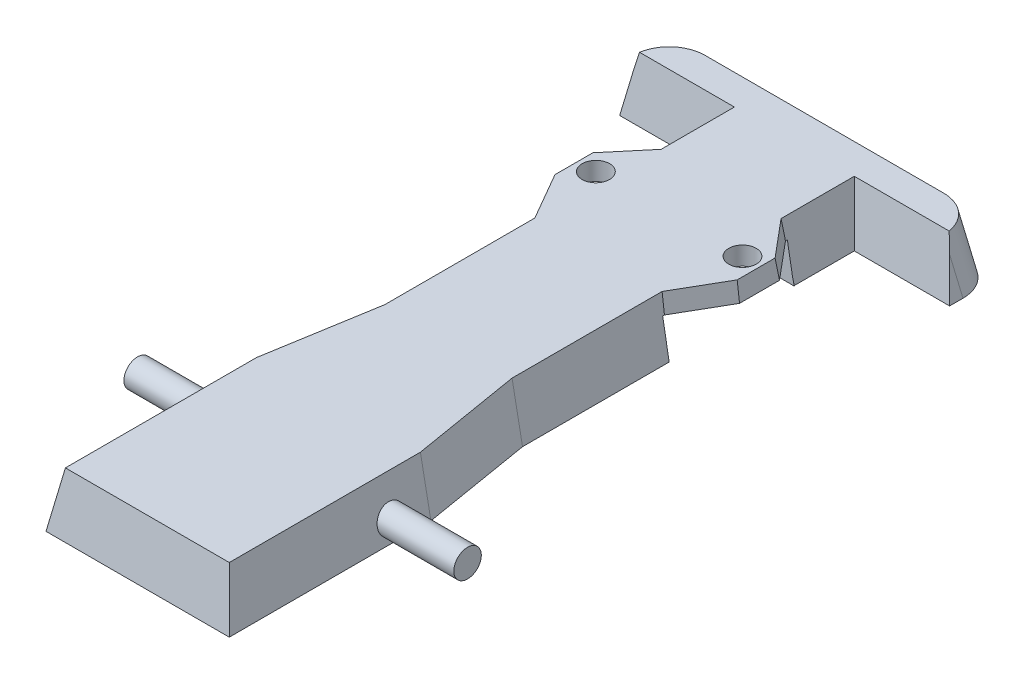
SolidWorks part; units mm, degrees
ref_plane "Front Plane" through (0, 0, 0) normal (0, 0, 1) x (1, 0, 0)
ref_plane "Top Plane" through (0, 0, 0) normal (0, 1, 0) x (1, 0, 0)
ref_plane "Right Plane" through (0, 0, 0) normal (1, 0, 0) x (0, 0, -1)
sketch "Sketch1" plane through (0, 0, 0) normal (0, 1, 0) x (1, 0, 0)
  line L0 (-254, 76.2) -> (254, 76.2) construction
  line L1 (-127, -355.6) -> (127, -355.6)
  line L5 (-139.7, 406.4) -> (-96.52, 457.8599)
  line L6 (-139.7, 345.3911) -> (-101.6, 279.4)
  line L10 (0, 609.6) -> (0, -355.6) construction
  line L12 (-139.7, 406.4) -> (-139.7, 345.3911)
  line L13 (254, 0) -> (-254, 0) construction
  line L15 (-127, -355.6) -> (-127, -76.2)
  line L16 (127, -355.6) -> (127, -76.2)
  line L18 (-254, -76.2) -> (254, 76.2) construction
  line L19 (254, -76.2) -> (-254, 76.2) construction
  line L22 (-101.6, 279.4) -> (-101.6, 76.2)
  line L23 (101.6, 279.4) -> (101.6, 76.2)
  line L24 (139.7, 345.3911) -> (101.6, 279.4)
  line L25 (139.7, 406.4) -> (96.52, 457.8599)
  line L26 (139.7, 406.4) -> (139.7, 345.3911)
  line L27 (-228.6, 609.6) -> (228.6, 609.6)
  line L29 (-228.6, 541.02) -> (-228.6, 609.6)
  line L31 (228.6, 541.02) -> (228.6, 609.6)
  line L32 (-228.6, 541.02) -> (-96.52, 541.02)
  line L33 (-96.52, 541.02) -> (-96.52, 457.8599)
  line L34 (96.52, 541.02) -> (228.6, 541.02)
  line L35 (96.52, 457.8599) -> (96.52, 541.02)
  line L36 (101.6, 76.2) -> (127, -76.2)
  line L37 (-101.6, 76.2) -> (-127, -76.2)
  circle A0 centre (-101.6, 381) radius 19.05
  circle A1 centre (101.6, 381) radius 19.05
  point P0 (0, 0)
extrude "Boss-Extrude1" add sketch "Sketch1" along normal blind 76.2
sketch "Sketch2" plane through (0, 0, 0) normal (0, -1, 0) x (1, 0, 0)
  line L1 (-139.7, -279.4) -> (139.7, -279.4)
  line L2 (-139.7, -279.4) -> (-139.7, -457.2)
  line L3 (-139.7, -457.2) -> (139.7, -457.2)
  line L4 (139.7, -279.4) -> (139.7, -457.2)
  dimension "D1" = 177.8
  dimension "D2" = 279.4
  dimension "D3" = 139.7
extrude "Cut-Extrude1" cut sketch "Sketch2" against normal blind 50.8
sketch "Sketch3" plane through (0, 76.2, 0) normal (0, 1, 0) x (1, 0, 0)
  line L0 (127, -355.6) -> (127, -76.2) construction
  line L1 (69.85, -146.05) -> (107.95, -146.05)
  line L2 (69.85, -146.05) -> (69.85, -107.95)
  line L3 (69.85, -107.95) -> (107.95, -107.95)
  line L4 (107.95, -146.05) -> (107.95, -107.95)
  line L5 (69.85, -146.05) -> (107.95, -107.95) construction
  line L6 (69.85, -107.95) -> (107.95, -146.05) construction
  line L7 (0, 0) -> (0, -355.6) construction
  line L8 (-127, -355.6) -> (127, -355.6) construction
  line L9 (-69.85, -107.95) -> (-107.95, -107.95)
  line L10 (-107.95, -146.05) -> (-107.95, -107.95)
  line L11 (-69.85, -146.05) -> (-107.95, -146.05)
  line L12 (-69.85, -146.05) -> (-69.85, -107.95)
  point P0 (88.9, -127)
extrude "Cut-Extrude2" [suppressed] cut sketch "Sketch3" against normal through all both and the other way through all
sketch "Sketch5" plane through (0, 76.2, 0) normal (0, 1, 0) x (1, 0, 0)
  line L0 (101.6, 381) -> (139.7, 381) construction
  line L1 (139.7, 345.3911) -> (139.7, 406.4) construction
  line L2 (0, -127) -> (101.6, -127) construction
  point P7 (0, -127)
  point P8 (101.6, -127)
  point P9 (0, 0)
  dimension "D1" = 508
sketch "Sketch6" plane through (139.7, 0, 0) normal (1, 0, 0) x (0, 0, -1)
  line L0 (381, 76.2) -> (381, 50.8) construction
  line L1 (345.3911, 76.2) -> (406.4, 76.2) construction
  line L2 (406.4, 50.8) -> (345.3911, 50.8) construction
sketch "Sketch4" plane through (-127, 0, 0) normal (-1, 0, 0) x (0, 0, 1)
  line L0 (76.2, 25.4) -> (355.6, 25.4) construction
  line L5 (-381, 76.2) -> (-381, 50.8) construction
  line L6 (76.2, 76.2) -> (76.2, 0) construction
  line L7 (355.6, 76.2) -> (355.6, 0) construction
  line L8 (76.2, 76.2) -> (355.6, 76.2) construction
  circle A0 centre (127, 25.4) radius 19.05
  point P12 (127, 25.4)
  dimension "D1" = 38.1
  dimension "D2" = 508
  dimension "D3" = 50.8
extrude "Boss-Extrude2" add sketch "Sketch4" along normal blind 101.6
mirror "Mirror1" about plane through (0, 0, 0) normal (1, 0, 0) of "Boss-Extrude2"
draft "Draft1" type of draft neutral plane draft angle 10 faces to draft 20 parameters "D1"=10
fillet "Fillet1" radius 50.8 2 edges at (-221.8819, 38.1, -602.8819) (221.8819, 38.1, -602.8819)
ref_plane "Plane1" through (0, -76.2, 0) normal (0, 1, 0) x (1, 0, 0)
sketch "Sketch7" plane through (0, -76.2, 0) normal (0, 1, 0) x (1, 0, 0)
  line L0 (178.5718, 609.6) -> (-178.5718, 609.6) construction
  point P0 (0, 127)
  point P3 (0, 127)
  point P4 (0, 0)
  dimension "D1" = 482.6
equation "\"D9@Sketch1\" = \"1.5@Sketch1\""
equation "\"D5@Sketch1\"=\"D10@Sketch1\""
equation "\"D2@Sketch3\"=\"D1@Sketch3\""
equation "\"D16@Sketch1\"=\"D11@Sketch1\""
equation "\"D20@Sketch1\"=\"D19@Sketch1\"/2"
equation "\"D7@Sketch1\"=\"D1@Sketch1\"/2"
